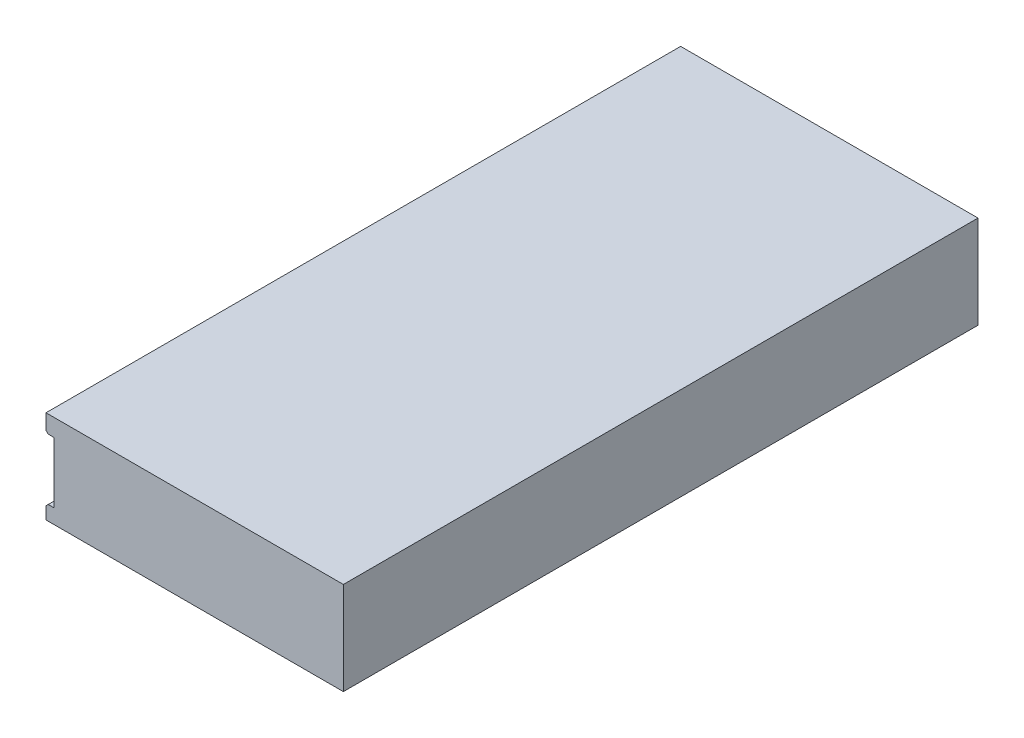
SolidWorks part; units mm, degrees
ref_plane "FRONT" through (0, 0, 0) normal (0, 0, 1) x (1, 0, 0)
ref_plane "TOP" through (0, 0, 0) normal (0, 1, 0) x (1, 0, 0)
ref_plane "RIGHT" through (0, 0, 0) normal (1, 0, 0) x (0, 0, -1)
sketch "Sketch1" plane through (0, 0, 0) normal (0, 0, 1) x (1, 0, 0)
  line L0 (50.673, 0) -> (50.673, -16.256)
  line L1 (50.673, -16.256) -> (-1.397, -16.256)
  line L2 (-1.397, -16.256) -> (-1.397, -13.716)
  line L3 (-1.397, -13.716) -> (0, -13.716)
  line L4 (0, -13.716) -> (0, -3.048)
  line L5 (0, -3.048) -> (-1.397, -3.048)
  line L6 (-1.397, -3.048) -> (-1.397, 0)
  line L7 (-1.397, 0) -> (50.673, 0)
  dimension "D1" = 52.07
  dimension "D2" = 50.673
  dimension "D3" = 3.048
  dimension "D4" = 2.54
  dimension "D5" = 16.256
extrude "Extrude1" add sketch "Sketch1" along normal mid plane 111.125
sketch "Sketch2" plane through (0, 0, 0) normal (-1, 0, 0) x (0, 0, 1)
  line L0 (0, 0) -> (0, -16.256) construction
  line L1 (55.5625, -16.256) -> (-55.5625, -16.256) construction
  line L2 (0, -8.128) -> (4.8768, -8.128) construction
  point P0 (-50.2666, -8.128)
  point P1 (50.2666, -8.128)
  point P2 (4.8768, -8.128)
  point P4 (-4.8768, -8.128)
  dimension "D1" = 50.2666
  dimension "D2" = 50.2666
  dimension "D3" = 4.8768
hole_wizard "#10-32 Tapped Hole1" positions "3DSketch1" profile "Sketch3" tap size "#10-32" standard "Ansi Inch"
sketch3d "3DSketch1"
  point P0 (0, -8.128, -50.2666)
  point P3 (0, -8.128, 50.2666)
  point P6 (0, -8.128, 4.8768)
  point P9 (0, -8.128, -4.8768)
sketch "Sketch3" plane through (0, -8.128, -50.2666) normal (0, 1, 0) x (0, 0, 1)
  line L0 (0, 0) -> (0, 11.2108)
  line L1 (0, 11.2108) -> (2.0193, 9.9974)
  line L2 (2.0193, 9.9974) -> (2.0193, 7.62)
  line L3 (2.0193, 7.62) -> (2.413, 7.62)
  line L4 (2.413, 7.62) -> (2.413, 0)
  line L5 (2.413, 0) -> (0, 0)
  line L10 (0, 11.2108) -> (-2.0193, 9.9974) construction
  line L11 (0, -6.35) -> (0, 107.95) construction
  dimension "Tap Drill Dia." = 4.0386
  dimension "Tap Drill Depth" = 9.9974
  dimension "Thread Major Dia." = 4.826
  dimension "Thread Depth" = 7.62
  dimension "Drill Angle" = 118
chamfer "Chamfer1" distance 0.381 angle 45 2 edges at (-1.397, -13.716, 0) (-1.397, -3.048, 0)
